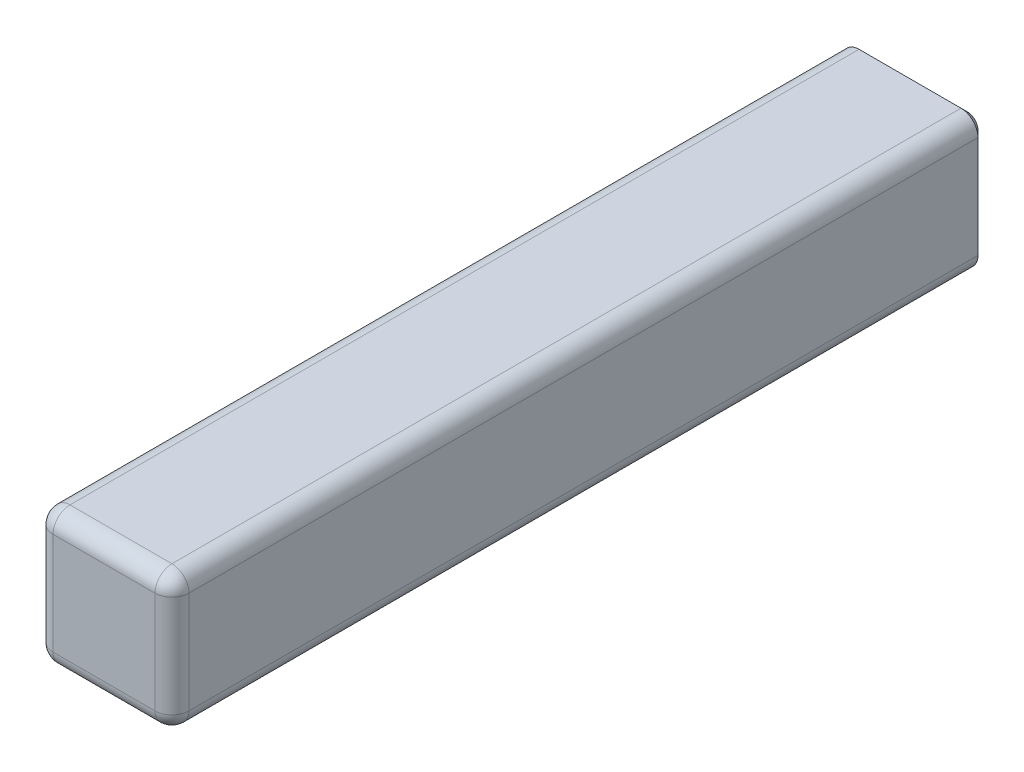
SolidWorks part; units mm, degrees
ref_plane "Front Plane" through (0, 0, 0) normal (1, 0, 0) x (0, 1, 0)
ref_plane "Top Plane" through (0, 0, 0) normal (0, 0, 1) x (0, 1, 0)
ref_plane "Right Plane" through (0, 0, 0) normal (0, 1, 0) x (-1, 0, 0)
sketch "8in beam" plane through (0, 0, 0) normal (0, 0, 1) x (0, 1, 0)
  line B0 (-76.2, -88.9) -> (76.2, -88.9)
  line B1 (-88.9, -76.2) -> (-88.9, 76.2)
  line B2 (76.2, 88.9) -> (-76.2, 88.9)
  line B3 (88.9, 76.2) -> (88.9, -76.2)
  line B4 (-76.2, -101.6) -> (76.2, -101.6)
  line B5 (-101.6, -76.2) -> (-101.6, 76.2)
  line B6 (76.2, 101.6) -> (-76.2, 101.6)
  line B7 (101.6, 76.2) -> (101.6, -76.2)
  arc B8 (101.6, 76.2) -> (76.2, 101.6) centre (76.2, 76.2) ccw
  arc B9 (76.2, -101.6) -> (101.6, -76.2) centre (76.2, -76.2) ccw
  arc B10 (-101.6, -76.2) -> (-76.2, -101.6) centre (-76.2, -76.2) ccw
  arc B11 (-76.2, 101.6) -> (-101.6, 76.2) centre (-76.2, 76.2) ccw
  arc B12 (-76.2, 88.9) -> (-88.9, 76.2) centre (-76.2, 76.2) ccw
  arc B13 (88.9, 76.2) -> (76.2, 88.9) centre (76.2, 76.2) ccw
  arc B14 (76.2, -88.9) -> (88.9, -76.2) centre (76.2, -76.2) ccw
  arc B15 (-88.9, -76.2) -> (-76.2, -88.9) centre (-76.2, -76.2) ccw
  line B16 (-76.2, 76.2) -> (76.2, -76.2) construction
sketch_block_instance "8x8x0.5-1"
sketch_block "8x8x0.5" parameters "D1"=25.4, "D2"=12.7, "D3"=12.7, "D4"=12.7, "D5"=203.2, "D6"=203.2, "D7"=177.8, "D8"=177.8
extrude "Boss-Extrude1" add sketch "8in beam" along normal blind 1366.667
sketch "Sketch1" plane through (0, 0, 1366.667) normal (0, 0, 1) x (1, 0, 0)
  line L0 (-76.2, 88.9) -> (76.2, 88.9)
  line L1 (-88.9, 76.2) -> (-88.9, -76.2)
  line L2 (-76.2, -88.9) -> (76.2, -88.9)
  line L3 (88.9, -76.2) -> (88.9, 76.2)
  arc A0 (88.9, 76.2) -> (76.2, 88.9) centre (76.2, 76.2) ccw
  arc A1 (88.9, -76.2) -> (76.2, -88.9) centre (76.2, -76.2) cw
  arc A2 (-76.2, 88.9) -> (-88.9, 76.2) centre (-76.2, 76.2) ccw
  arc A3 (-88.9, -76.2) -> (-76.2, -88.9) centre (-76.2, -76.2) ccw
  dimension "D1" = 12.7
  dimension "D2" = 12.7
  dimension "D3" = 12.7
extrude "Boss-Extrude2" add sketch "Sketch1" against normal blind 25.4
fillet "Fillet1" radius 25.4 8 edges at (94.1605, -94.1605, 1366.667) (101.6, 0, 1366.667) (94.1605, 94.1605, 1366.667) (0, 101.6, 1366.667) (-94.1605, 94.1605, 1366.667) (-101.6, 0, 1366.667) (-94.1605, -94.1605, 1366.667) (0, -101.6, 1366.667)
sketch "Sketch2" plane through (0, 0, 0) normal (0, 1, 0) x (-1, 0, 0)
  line L0 (-76.2, 0) -> (76.2, 0) construction
  line L1 (-258.055, 152.4) -> (281.418, 152.4)
  line L2 (-258.055, 152.4) -> (-258.055, -217.1602)
  line L3 (-258.055, -217.1602) -> (281.418, -217.1602)
  line L4 (281.418, 152.4) -> (281.418, -217.1602)
  dimension "D1" = 152.4
extrude "Cut-Extrude1" cut sketch "Sketch2" against normal through all both and the other way through all
chamfer "Chamfer1" distance 9.525 angle 45 8 edges at (-94.1605, 94.1605, 152.4) (-101.6, 0, 152.4) (-94.1605, -94.1605, 152.4) (0, -101.6, 152.4) (94.1605, -94.1605, 152.4) (101.6, 0, 152.4) (94.1605, 94.1605, 152.4) (0, 101.6, 152.4)
